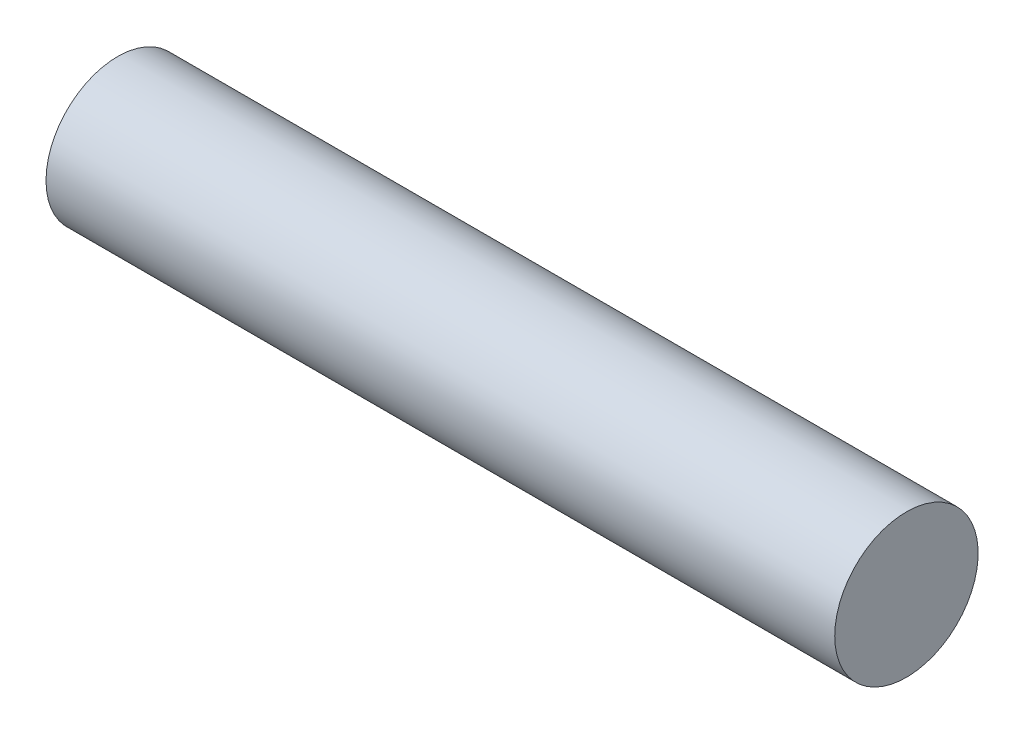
SolidWorks part; units mm, degrees
ref_plane "前视" through (0, 0, 0) normal (0, 0, 1) x (1, 0, 0)
ref_plane "上视" through (0, 0, 0) normal (0, 1, 0) x (1, 0, 0)
ref_plane "右视" through (0, 0, 0) normal (1, 0, 0) x (0, 0, -1)
sketch "草图1" plane through (0, 0, 0) normal (0, 1, 0) x (1, 0, 0)
  line L0 (0, 0) -> (55, 0)
  line L1 (55, 0) -> (55, 5)
  line L2 (55, 5) -> (29, 5)
  line L3 (29, 5) -> (20, 5)
  line L4 (20, 5) -> (0, 5)
  line L5 (0, 5) -> (0, 0)
  line L6 (0, 0) -> (35, 0) construction
  point P0 (0, 0)
revolve "旋转1" add sketch "草图1" angle 360 about L6
